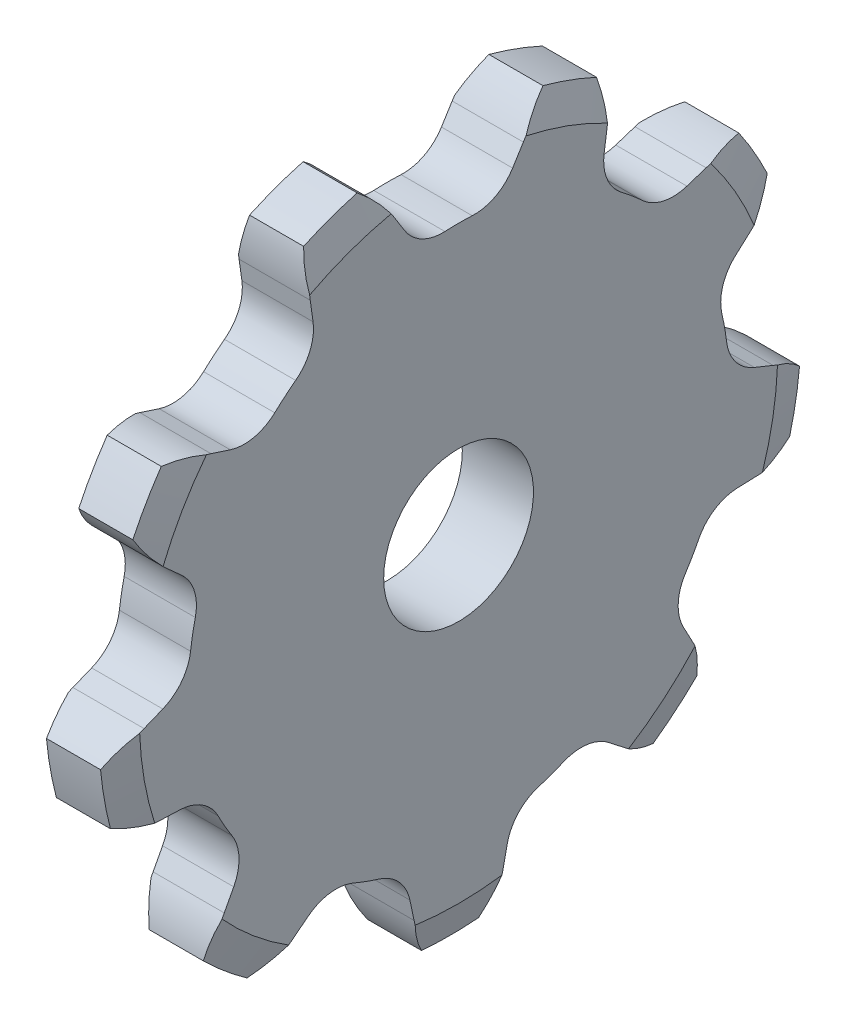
SolidWorks part; units mm, degrees
ref_plane "Plane1" through (0, 0, 0) normal (0, 0, 1) x (1, 0, 0)
ref_plane "Plane2" through (0, 0, 0) normal (0, 1, 0) x (1, 0, 0)
ref_plane "Plane3" through (0, 0, 0) normal (1, 0, 0) x (0, 0, -1)
other "Configuration Table"
sketch "Clipboard" plane through (0, 0, 0) normal (0, 1, 0) x (1, 0, 0)
  line L0 (0, 0) -> (75.2619, -11.9203)
  line L1 (-15, 0) -> (100, 0) construction
  line L2 (0, 0) -> (-2.1039, 2.3779)
  line L3 (0, 0) -> (-11.863, 4.5341)
  line L4 (0, 0) -> (8.5297, 1.351)
  line L5 (0, 0) -> (-71.3958, -26.6285)
  line L6 (0, 0) -> (-20.0029, -13.496)
  line L7 (-2.1039, 2.3779) -> (14.2981, 76.7917)
  line L8 (-76.2, 54.61) -> (-19.7358, 54.61)
  line L9 (-66.6514, 23.5599) -> (-48.0177, 27.5206)
  line L10 (-76.2, 71.12) -> (35.1969, 71.12)
  line L11 (0, 0) -> (-25.4, 0)
  line L12 (-76.2, 101.6) -> (-47.498, 101.6)
  circle A0 centre (0, 0) radius 19.05
  circle A1 centre (0, 0) radius 25.4
  circle A2 centre (0, 0) radius 25.4
sketch "BasProSke" plane through (0, 0, 0) normal (0, 1, 0) x (1, 0, 0)
  line L0 (-10, 0) -> (60, 0) construction
  line L1 (0, 0) -> (0, 108.2234)
  line L2 (0, 0) -> (24.13, 0)
  line L3 (24.13, 0) -> (24.13, 108.2234)
  line L4 (21.2344, 119.0299) -> (2.8956, 119.0299)
  line L5 (0, 108.2234) -> (2.8956, 119.0299)
  line L6 (24.13, 108.2234) -> (21.2344, 119.0299)
revolve "Base-Revolve" add sketch "BasProSke" angle 360 about L0
sketch "TooCutSke" plane through (0, 0, 0) normal (1, 0, 0) x (0, 0, -1)
  line L0 (-18.3254, 98.6123) -> (-21.9596, 104.4283)
  line L1 (0, 0) -> (0, 107) construction
  line L2 (3.81, 0) -> (3.81, 141.3423) construction
  line L3 (18.3254, 98.6123) -> (21.9596, 104.4283)
  line L4 (44.0158, 120.9324) -> (48.3595, 132.8665)
  line L5 (3.81, 115.7694) -> (59.0408, 81.2573) construction
  line L6 (-44.0158, 120.9324) -> (-48.3595, 132.8665)
  arc A0 (4.6306, 91.4678) -> (-4.6306, 91.4678) centre (0, 0) ccw
  arc A1 (4.6306, 91.4678) -> (18.3254, 98.6123) centre (5.4011, 106.6883) ccw
  arc A2 (-4.6306, 91.4678) -> (-18.3254, 98.6123) centre (-5.4011, 106.6883) cw
  circle A3 centre (0, 0) radius 111.3969 construction
  circle A4 centre (3.81, 111.3318) radius 19.05 construction
  arc A5 (21.9596, 104.4283) -> (44.0158, 120.9324) centre (54.2702, 84.2383) cw
  arc A6 (-21.9596, 104.4283) -> (-44.0158, 120.9324) centre (-54.2702, 84.2383) ccw
  arc A7 (48.3595, 132.8665) -> (-48.3595, 132.8665) centre (0, 0) ccw
extrude "ToothCut" cut sketch "TooCutSke" along normal through all
pattern_circular "TeethCuts" count 9 every 40 about axis through (-10, 0, 0) along (1, 0, 0) of "ToothCut"
sketch "HubNeaOneSke" plane through (0, 0, 0) normal (-1, 0, 0) x (0, 0, 1)
  circle A0 centre (0, 0) radius 25.4
extrude "HubNearOne" [suppressed] add sketch "HubNeaOneSke" along normal blind 52.0701
sketch "HubNeaBotSke" plane through (0, 0, 0) normal (-1, 0, 0) x (0, 0, 1)
  circle A0 centre (0, 0) radius 25.4
extrude "HubNearBoth" [suppressed] add sketch "HubNeaBotSke" along normal blind 26.035
ref_plane "FarPln" through (24.13, 0, 0) normal (1, 0, 0) x (0, 0, -1)
sketch "HubFarSke" plane through (24.13, 0, 0) normal (1, 0, 0) x (0, 0, -1)
  circle A0 centre (0, 0) radius 25.4
extrude "HubFar" [suppressed] add sketch "HubFarSke" along normal blind 26.035
sketch "BorSke" plane through (0, 0, 0) normal (1, 0, 0) x (0, 0, -1)
  circle A0 centre (0, 0) radius 25.4
extrude "Bore" cut sketch "BorSke" along normal mid plane 152.4001
sketch "KeySke" plane through (0, 0, 0) normal (1, 0, 0) x (0, 0, -1)
  line L0 (-6.35, 0) -> (-6.35, 31.0642)
  line L1 (-6.35, 31.0642) -> (6.35, 31.0642)
  line L2 (6.35, 31.0642) -> (6.35, 0)
  line L3 (0, 0) -> (0, 34) construction
  line L4 (-6.35, 0) -> (6.35, 0)
extrude "Keyway" [suppressed] cut sketch "KeySke" along normal mid plane 152.4001
pattern_circular "Keyway2" [suppressed] count 2 every 90 about axis through (-10, 0, 0) along (1, 0, 0)
equation "\"Thickness@Clipboard\" = \"Width@Clipboard\" * 0.95"
equation "\"H@Clipboard\" = \"Diameter@Clipboard\" / 2.0"
equation "\"OAL@Clipboard\" = \"Thickness@Clipboard\""
equation "\"Pitch_radius@Clipboard\" = ( \"Pitch@Clipboard\" / 2.0) / sin(3.14159265 / \"Num_teeth@Clipboard\" )"
equation "\"MHD@Clipboard\" = (1.0 / tan(3.14159265 / \"Num_teeth@Clipboard\" ) - 0.05) * \"Pitch@Clipboard\" - \"F@Clipboard\""
equation "\"MHD@Clipboard\" = ((sgn( \"MHD@Clipboard\" - \"Hub_dia@Clipboard\" )-1)*( \"MHD@Clipboard\" - \"Hub_dia@Clipboard\" ))/-2+ \"Hub_dia@Clipboard\""
equation "\"OAL@Clipboard\" = ((sgn( \"OAL@Clipboard\" - \"Overall_len@Clipboard\" )+1)*( \"OAL@Clipboard\" - \"Overall_len@Clipboard\" ))/2 + \"Overall_len@Clipboard\" + 0.000002"
equation "\"Num_teeth@TeethCuts\" = int( \"Show_teeth@Clipboard\" ) + 1"
equation "\"Num_teeth@TeethCuts\" = ((sgn( \"Num_teeth@TeethCuts\" - \"Num_teeth@Clipboard\" )-1)*( \"Num_teeth@TeethCuts\" - \"Num_teeth@Clipboard\" ))/-2+ \"Num_teeth@Clipboard\""
equation "\"Num_teeth@TeethCuts\" = ((sgn( \"Num_teeth@TeethCuts\" - 2.0)+1)*( \"Num_teeth@TeethCuts\" - 2.0))/2 +2.0"
equation "\"Angle@TeethCuts\" = 360.0 / \"Num_teeth@Clipboard\""
equation "\"Pitch_radius@TooCutSke\" = \"Pitch_radius@Clipboard\""
equation "\"Cp@TooCutSke\" = 0.05 * \"Pitch@Clipboard\""
equation "\"Rt@TooCutSke\" = 0.5 * \"Pitch@Clipboard\""
equation "\"R@TooCutSke\"  = 0.8 * \"H@Clipboard\""
equation "\"Db@TooCutSke\" = \"Pitch_radius@Clipboard\" - \"H@Clipboard\" - 0.03"
equation "\"Ag@TooCutSke\" =  2.0 * \"Ap@Clipboard\" + 360.0 / \"Num_teeth@Clipboard\""
equation "\"H@TooCutSke\" = \"H@Clipboard\""
equation "\"Angle@TooCutSke\" =  360.0 / \"Num_teeth@Clipboard\""
equation "\"Wf@TooCutSke\" = 0.01 * \"Pitch@Clipboard\" * \"Num_teeth@Clipboard\""
equation "\"Wf@TooCutSke\" = ((sgn( \"Wf@TooCutSke\" - \"H@Clipboard\" * 0.8 )-1)*( \"Wf@TooCutSke\" - \"H@Clipboard\" * 0.8 ))/-2+ \"H@Clipboard\" * 0.8"
equation "\"Diameter@BasProSke\" = (1.0 / tan(3.14159265 / \"Num_teeth@Clipboard\" )) * \"Pitch@Clipboard\" + \"F@Clipboard\""
equation "\"Thickness@BasProSke\"  = \"Thickness@Clipboard\""
equation "\"G1@BasProSke\" =  \"Thickness@Clipboard\" * 0.12"
equation "\"G2@BasProSke\" =   \"Thickness@Clipboard\" * 0.12"
equation "\"MHD@Clipboard\" = ((sgn( \"MHD@Clipboard\" - \"Db@TooCutSke\" * 2.0  )-1)*( \"MHD@Clipboard\" - \"Db@TooCutSke\" * 2.0 ))/-2+ \"Db@TooCutSke\" * 2.0"
equation "\"Diameter@HubNeaOneSke\" = \"MHD@Clipboard\""
equation "\"Length@HubNearOne\" = \"OAL@Clipboard\" - \"Thickness@BasProSke\""
equation "\"Diameter@HubNeaBotSke\" = \"MHD@Clipboard\""
equation "\"Length@HubNearBoth\" = ( \"OAL@Clipboard\" - \"Thickness@BasProSke\" ) / 2.0"
equation "\"Thickness@FarPln\" = \"Thickness@BasProSke\""
equation "\"Diameter@HubFarSke\" = \"MHD@Clipboard\""
equation "\"Length@HubFar\" = ( \"OAL@Clipboard\" - \"Thickness@BasProSke\" ) / 2.0"
equation "\"D1@Bore\" = \"OAL@Clipboard\" * 2.0"
equation "\"D1@Keyway\" = \"OAL@Clipboard\" * 2.0"
equation "\"Offset@KeySke\" = \"T_dim@Clipboard\" - \"Diameter@BorSke\" / 2.0"
